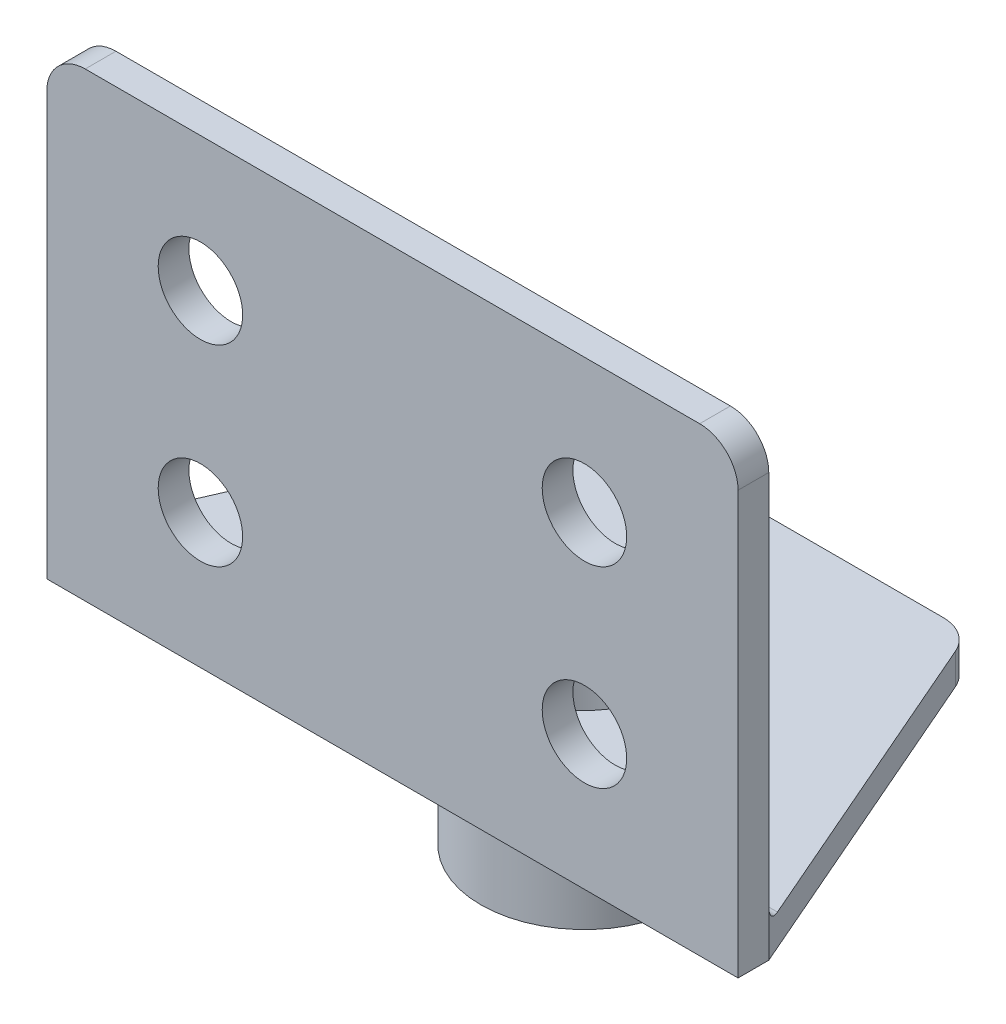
SolidWorks part; units mm, degrees
ref_plane "Front Plane" through (0, 0, 0) normal (0, 0, 1) x (1, 0, 0)
ref_plane "Top Plane" through (0, 0, 0) normal (0, 1, 0) x (1, 0, 0)
ref_plane "Right Plane" through (0, 0, 0) normal (1, 0, 0) x (0, 0, -1)
sketch "Sketch1" plane through (0, 0, 0) normal (1, 0, 0) x (0, 0, -1)
  line L0 (-21, 4) -> (25, 4)
  line L2 (-25, 0) -> (-25, 60)
  line L3 (-25, 60) -> (-21, 60)
  line L4 (-21, 4) -> (-21, 60)
  line L5 (25, 4) -> (25, 0)
  line L6 (25, 0) -> (-25, 0)
  dimension "D1" = 4
  dimension "D2" = 4
  dimension "D3" = 60
  dimension "D4" = 50
  dimension "D5" = 25
extrude "Boss-Extrude1" add sketch "Sketch1" along normal mid plane 90
sketch "Sketch2" plane through (0, 4, 0) normal (0, 1, 0) x (1, 0, 0)
  line L0 (-45, -21) -> (-26.3071, 21.9936)
  line L1 (45, 25) -> (-45, 25) construction
  line L2 (0, 0) -> (0, 33.4249) construction
  line L3 (45, -21) -> (26.3071, 21.9936)
  line L4 (-21.7218, 25) -> (21.7218, 25)
  line L5 (-45, -21) -> (-94.3966, -21)
  line L6 (-94.3966, -21) -> (-94.3966, 48.8649)
  line L7 (-94.3966, 48.8649) -> (81.944, 48.8649)
  line L8 (81.944, 48.8649) -> (81.944, -21)
  line L9 (81.944, -21) -> (45, -21)
  circle A0 centre (0, 0) radius 12.5
  arc A1 (26.3071, 21.9936) -> (21.7218, 25) centre (21.7218, 20) ccw
  arc A2 (-21.7218, 25) -> (-26.3071, 21.9936) centre (-21.7218, 20) ccw
  point P17 (25, 25)
  point P20 (-25, 25)
  dimension "D2" = 25
  dimension "D3" = 5
  dimension "D1" = 25
extrude "Cut-Extrude1" cut sketch "Sketch2" against normal blind 90
fillet "Fillet1" radius 5 2 edges at (45, 60, 23) (-45, 60, 23)
fillet "Fillet2" radius 2 1 edges at (0, 4, 21)
sketch "Sketch3" plane through (0, 0, 0) normal (0, -1, 0) x (1, 0, 0)
  circle A0 centre (0, 0) radius 13.5
  circle A1 centre (0, 0) radius 12.5 construction
  circle A2 centre (0, 0) radius 12.5
  dimension "D1" = 27
extrude "Boss-Extrude2" add sketch "Sketch3" along normal blind 20
fillet "Fillet3" radius 2 1 edges at (0, 0, 13.5)
sketch "Sketch4" plane through (0, 0, 21) normal (0, 0, -1) x (-1, 0, 0)
  line L0 (-40, 60) -> (40, 60) construction
  line L1 (-25, 42.5) -> (25, 42.5) construction
  line L2 (-25, 42.5) -> (-25, 17.5) construction
  line L3 (-25, 17.5) -> (25, 17.5) construction
  line L4 (25, 42.5) -> (25, 17.5) construction
  line L5 (-25, 42.5) -> (25, 17.5) construction
  line L6 (-25, 17.5) -> (25, 42.5) construction
  line L7 (45, 6) -> (45, 55) construction
  circle A0 centre (-25, 42.5) radius 5.5
  circle A1 centre (25, 42.5) radius 5.5
  circle A2 centre (25, 17.5) radius 5.5
  circle A3 centre (-25, 17.5) radius 5.5
  point P0 (0, 30)
  point P11 (25, 30)
  dimension "D4" = 11
  dimension "D1" = 30
  dimension "D2" = 50
  dimension "D3" = 25
  dimension "D5" = 20
extrude "Cut-Extrude2" cut sketch "Sketch4" against normal blind 25
